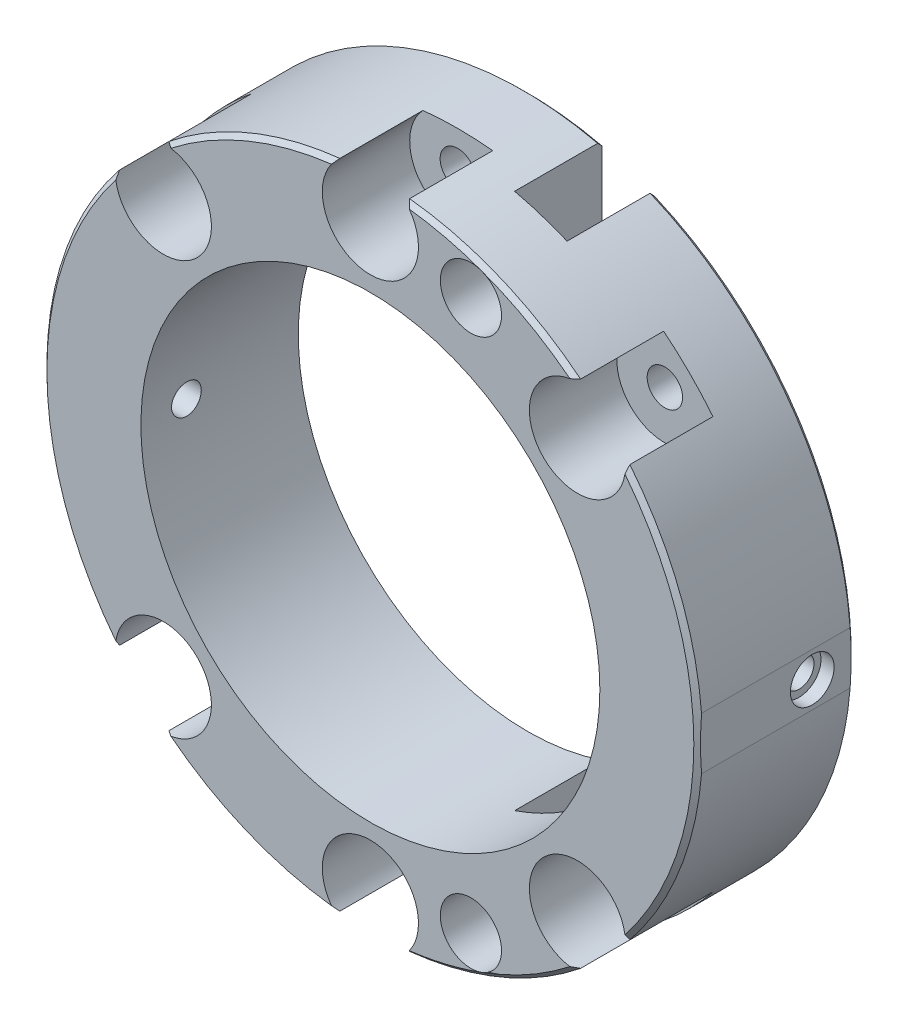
SolidWorks part; units mm, degrees
ref_plane "Plan1" through (0, 0, 0) normal (0, 0, 1) x (1, 0, 0)
ref_plane "Plan2" through (0, 0, 0) normal (0, 1, 0) x (1, 0, 0)
ref_plane "Plan3" through (0, 0, 0) normal (1, 0, 0) x (0, 0, -1)
sketch "Esquisse1" plane through (0, 0, 0) normal (0, 0, 1) x (1, 0, 0)
  line L0 (0, 0) -> (0, 67) construction
  line L1 (47.3762, 47.3762) -> (0, 0) construction
  line L2 (-94.7192, 0) -> (94.7192, 0) construction
  circle A1 centre (0, 0) radius 75
  circle A3 centre (0, 0) radius 52.5
  circle A5 centre (47.3762, 47.3762) radius 4.05
  circle A7 centre (0, 67) radius 4.05
  circle A9 centre (0, 0) radius 67 construction
  circle A11 centre (-47.3762, 47.3762) radius 4.05
  circle A13 centre (-47.3762, -47.3762) radius 4.05
  circle A14 centre (0, -67) radius 4.05
  circle A15 centre (47.3762, -47.3762) radius 4.05
  dimension "D1" = 105
  dimension "D2" = 150
  dimension "D3" = 134
  dimension "D5" = 8.1
  dimension "D4" = 45
extrude "Base-Extrusion" add sketch "Esquisse1" along normal blind 36
sketch "Esquisse2" plane through (0, 0, 36) normal (0, 0, 1) x (1, 0, 0)
  line L0 (0, 76.8104) -> (0, -76.8104) construction
  line L1 (-89.4447, 0) -> (89.4447, 0) construction
  line L2 (-74.7596, 6) -> (-74.7596, -6)
  line L8 (74.7596, 6) -> (74.7596, -6)
  arc A0 (74.7596, -6) -> (74.7596, 6) centre (0, 0) ccw
  circle A1 centre (0, 0) radius 75 construction
  arc A2 (-74.7596, -6) -> (-74.7596, 6) centre (0, 0) cw
  dimension "D1" = 12
extrude "Enlèv. mat.-Extru.1" cut sketch "Esquisse2" against normal through all
sketch "Esquisse8" plane through (74.7596, 0, 0) normal (1, 0, 0) x (0, 0, -1)
  line L2 (84.1076, 0) -> (-84.1076, 0) construction
  line L4 (0, -75) -> (0, -6) construction
  circle A0 centre (-9.67, 0) radius 5
  dimension "D1" = 9.67
  dimension "D2" = 10
extrude "Enlèv. mat.-Extru.7" cut sketch "Esquisse8" against normal blind 3
sketch "Esquisse9" plane through (71.7596, 0, 0) normal (1, 0, 0) x (0, 0, -1)
  circle A0 centre (-9.67, 0) radius 3.4
  dimension "D1" = 6.8
extrude "Enlèv. mat.-Extru.8" cut sketch "Esquisse9" against normal up to next
sketch "Esquisse10" plane through (-74.7596, 0, 0) normal (-1, 0, 0) x (0, 0, 1)
  line L0 (113.1557, 0) -> (-113.1557, 0) construction
  line L1 (36, -75) -> (36, -6) construction
  circle A0 centre (25.59, 0) radius 5
  dimension "D2" = 10
  dimension "D1" = 10.41
extrude "Enlèv. mat.-Extru.9" cut sketch "Esquisse10" against normal blind 3
sketch "Esquisse11" plane through (-71.7596, 0, 0) normal (-1, 0, 0) x (0, 0, 1)
  circle A0 centre (25.59, 0) radius 3.4
  dimension "D1" = 6.8
extrude "Enlèv. mat.-Extru.10" cut sketch "Esquisse11" against normal up to next
sketch "Esquisse12" plane through (0, 0, 36) normal (0, 0, 1) x (1, 0, 0)
  circle A0 centre (47.3762, 47.3762) radius 11
  circle A1 centre (0, 67) radius 11
  circle A2 centre (-47.3762, 47.3762) radius 11
  circle A3 centre (-47.3762, -47.3762) radius 11
  circle A4 centre (0, -67) radius 11
  circle A5 centre (47.3762, -47.3762) radius 11
  dimension "D1" = 22
extrude "Enlèv. mat.-Extru.11" cut sketch "Esquisse12" against normal blind 20
sketch "Esquisse13" plane through (0, 0, 0) normal (0, 0, -1) x (-1, 0, 0)
  line L0 (-29, 80) -> (-17, 80)
  line L1 (-29, 80) -> (-29, -80)
  line L2 (-17, -80) -> (-29, -80)
  line L3 (-17, -80) -> (-17, 80)
  line L4 (-23, 80.9014) -> (-23, -83.0385) construction
  line L5 (30.9105, 0) -> (-84.1833, 0) construction
  dimension "D1" = 23
  dimension "D2" = 12
  dimension "D3" = 160
extrude "Enlèv. mat.-Extru.12" cut sketch "Esquisse13" against normal blind 20
sketch "Esquisse14" plane through (0, 0, 36) normal (0, 0, 1) x (1, 0, 0)
  line L0 (23, 74.5746) -> (23, -73.0479) construction
  line L1 (-90.4417, 0) -> (90.4417, 0) construction
  circle A0 centre (0, 0) radius 67 construction
  circle A1 centre (23, 62.9285) radius 4.05
  circle A2 centre (23, -62.9285) radius 4.05
  dimension "D2" = 8.1
  dimension "D3" = 134
  dimension "D1" = 23
extrude "Enlèv. mat.-Extru.13" cut sketch "Esquisse14" against normal through all
sketch "Esquisse15" plane through (0, 0, 36) normal (0, 0, 1) x (1, 0, 0)
  circle A0 centre (23, 62.9285) radius 7
  circle A1 centre (23, -62.9285) radius 7
  circle A2 centre (23, -62.9285) radius 4.05 construction
  circle A3 centre (23, 62.9285) radius 4.05 construction
  dimension "D1" = 14
extrude "Enlèv. mat.-Extru.14" cut sketch "Esquisse15" against normal blind 10
chamfer "Chanfrein1" distance 1 angle 45
sketch "Esquisse16" plane through (-74.7596, 0, 0) normal (-1, 0, 0) x (0, 0, 1)
  line L0 (-36.7169, 0) -> (36.7169, 0) construction
  line L1 (0, 50) -> (17, 50)
  line L2 (0, 50) -> (0, -50)
  line L3 (0, -50) -> (17, -50)
  line L4 (17, 50) -> (17, -50)
  line L5 (0, 74) -> (0, -74) construction
  dimension "D1" = 17
  dimension "D2" = 100
extrude "Enlèv. mat.-Extru.15" cut sketch "Esquisse16" against normal blind 10
